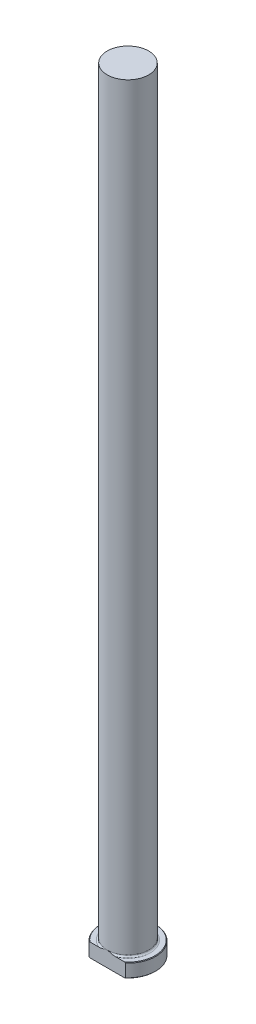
SolidWorks part; units mm, degrees
ref_plane "Front Plane" through (0, 0, 0) normal (0, 0, 1) x (1, 0, 0)
ref_plane "Top Plane" through (0, 0, 0) normal (0, 1, 0) x (1, 0, 0)
ref_plane "Right Plane" through (0, 0, 0) normal (1, 0, 0) x (0, 0, -1)
sketch "Sketch1" plane through (0, 0, 0) normal (0, 0, 1) x (1, 0, 0)
  line L0 (0, 259.9588) -> (0, -15.1925) construction
  line L1 (0, 0) -> (-12.7, 0)
  line L2 (-12.7, 0) -> (-12.7, 6.35)
  line L3 (-12.7, 6.35) -> (-9.525, 6.35)
  line L4 (-9.525, 6.35) -> (-9.525, 355.6)
  line L5 (-9.525, 355.6) -> (0, 355.6)
  line L6 (0, 355.6) -> (0, 0)
  dimension "L" = 355.6
  dimension "H" = 25.4
  dimension "T" = 6.35
  dimension "D" = 19.05
revolve "Revolve1" add sketch "Sketch1" angle 360 about L0
chamfer "Chamfer1" distance 0.254 angle 45 2 edges at (0, 6.35, 12.7) (0, 0, 12.7)
fillet "Fillet1" radius 0.762 1 edges at (0, 6.35, 9.525)
sketch "Sketch2" plane through (0, 0, 0) normal (0, -1, 0) x (1, 0, 0)
  line L0 (-8.4003, 9.525) -> (8.4003, 9.525)
  arc A0 (8.4003, 9.525) -> (-8.4003, 9.525) centre (0, 0) ccw
  circle A1 centre (0, 0) radius 12.7 construction
  circle A3 centre (0, 0) radius 9.525 construction
extrude "KEY" cut sketch "Sketch2" against normal through all
sketch "Pocket Sketch" plane through (0, 0, 0) normal (0, 0, 1) x (1, 0, 0)
  line L0 (-13.0969, 0) -> (-13.0969, 6.3754)
  line L1 (-13.0969, 6.3754) -> (-10.6839, 6.3754)
  line L2 (-9.9219, 7.1374) -> (-9.9219, 22.225)
  line L3 (-9.9219, 22.225) -> (0, 22.225)
  line L4 (0, 22.225) -> (0, 0)
  line L5 (0, 0) -> (-13.0969, 0)
  line L6 (0, 12.6104) -> (0, -2.4989) construction
  line L7 (-12.7, 6.096) -> (-12.7, 0.254) construction
  line L8 (12.446, 6.35) -> (-12.446, 6.35) construction
  line L9 (-9.525, 355.6) -> (-9.525, 7.112) construction
  line L10 (-10.6839, 6.3754) -> (-9.9219, 7.1374)
  point P3 (-9.9219, 6.3754)
  dimension "D1" = 26.1937
  dimension "D2" = 0.3969
  dimension "D3" = 0.0254
  dimension "D4" = 0.3969
  dimension "D5" = 19.8437
  dimension "D6" = 22.225
